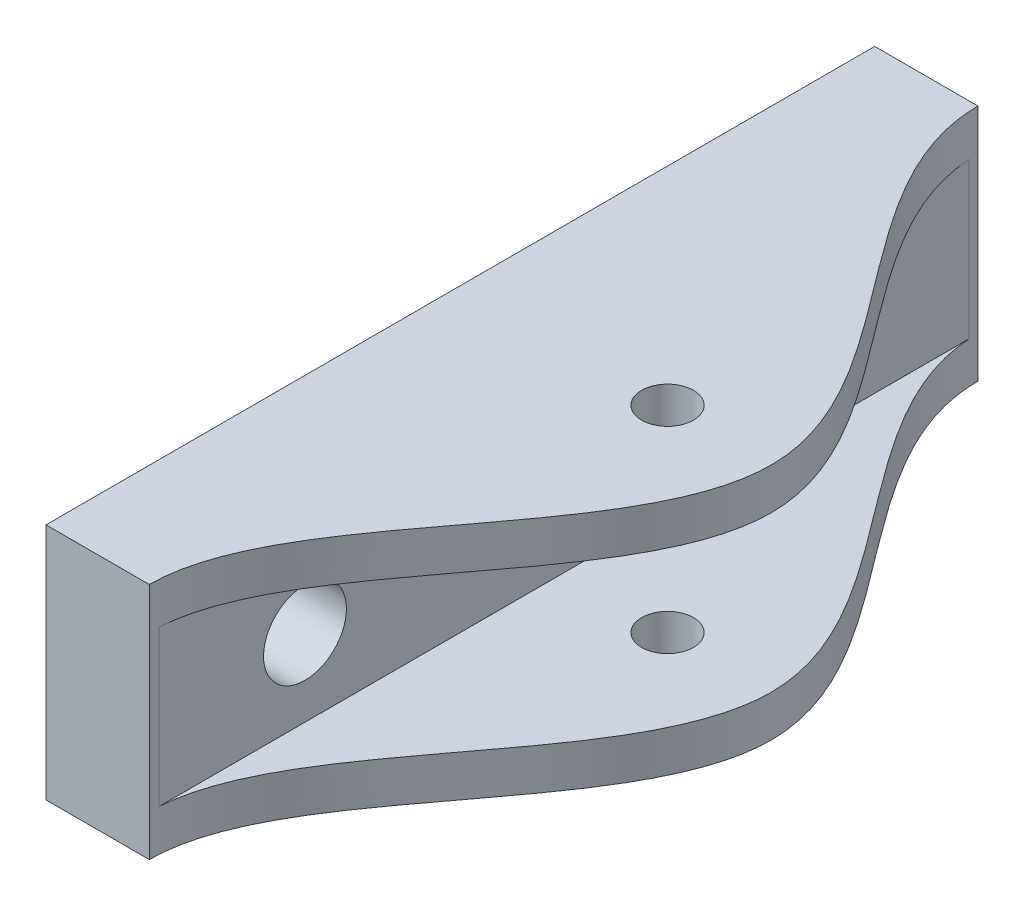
SolidWorks part; units mm, degrees
ref_plane "Front Plane" through (0, 0, 0) normal (0, 0, 1) x (1, 0, 0)
ref_plane "Top Plane" through (0, 0, 0) normal (0, 1, 0) x (1, 0, 0)
ref_plane "Right Plane" through (0, 0, 0) normal (1, 0, 0) x (0, 0, -1)
sketch "Sketch1" plane through (0, 0, 0) normal (0, 0, 1) x (1, 0, 0)
  line L2 (-44.8951, -15.3781) -> (-44.8951, -38.3781)
  line L3 (-44.8951, -15.3781) -> (-14.8951, -15.3781)
  line L4 (-34.8951, -19.3781) -> (-34.8951, -34.3781)
  line L5 (-34.8951, -34.3781) -> (-14.8951, -34.3781)
  line L7 (-44.8951, -38.3781) -> (-14.8951, -38.3781)
  line L8 (-14.8951, -34.3781) -> (-14.8951, -38.3781)
  line L9 (-34.8951, -19.3781) -> (-14.8951, -19.3781)
  line L10 (-14.8951, -15.3781) -> (-14.8951, -19.3781)
extrude "Boss-Extrude1" add sketch "Sketch1" along normal blind 80
sketch "Sketch2" plane through (-44.8951, 0, 0) normal (-1, 0, 0) x (0, 0, 1)
  circle A0 centre (15, -26.8781) radius 4
  circle A1 centre (65, -26.8781) radius 4
extrude "Cut-Extrude1" cut sketch "Sketch2" against normal blind 10
sketch "Sketch3" plane through (0, -15.3781, 0) normal (0, 1, 0) x (1, 0, 0)
  circle A0 centre (-24.8951, -40) radius 2.5
  point P0 (0, 0)
extrude "Cut-Extrude4" cut sketch "Sketch3" against normal blind 23
sketch "Sketch5" plane through (0, -38.3781, 0) normal (0, -1, 0) x (1, 0, 0)
  line L0 (-14.8951, 0) -> (-13.9282, 40)
  line L1 (-14.8951, 0) -> (-34.9252, 0)
  line L2 (-13.9282, 40) -> (-14.8951, 80)
  line L3 (-14.8951, 80) -> (-34.9252, 80)
  spline S0 degree 3 poles (-34.9252, 0) (-34.9252, 13.3333) (5.135, 40) (-34.9252, 66.6667) (-34.9252, 80) knots 0 0 0 0 0.5 1 1 1 1
extrude "Cut-Extrude6" cut sketch "Sketch5" against normal blind 23
